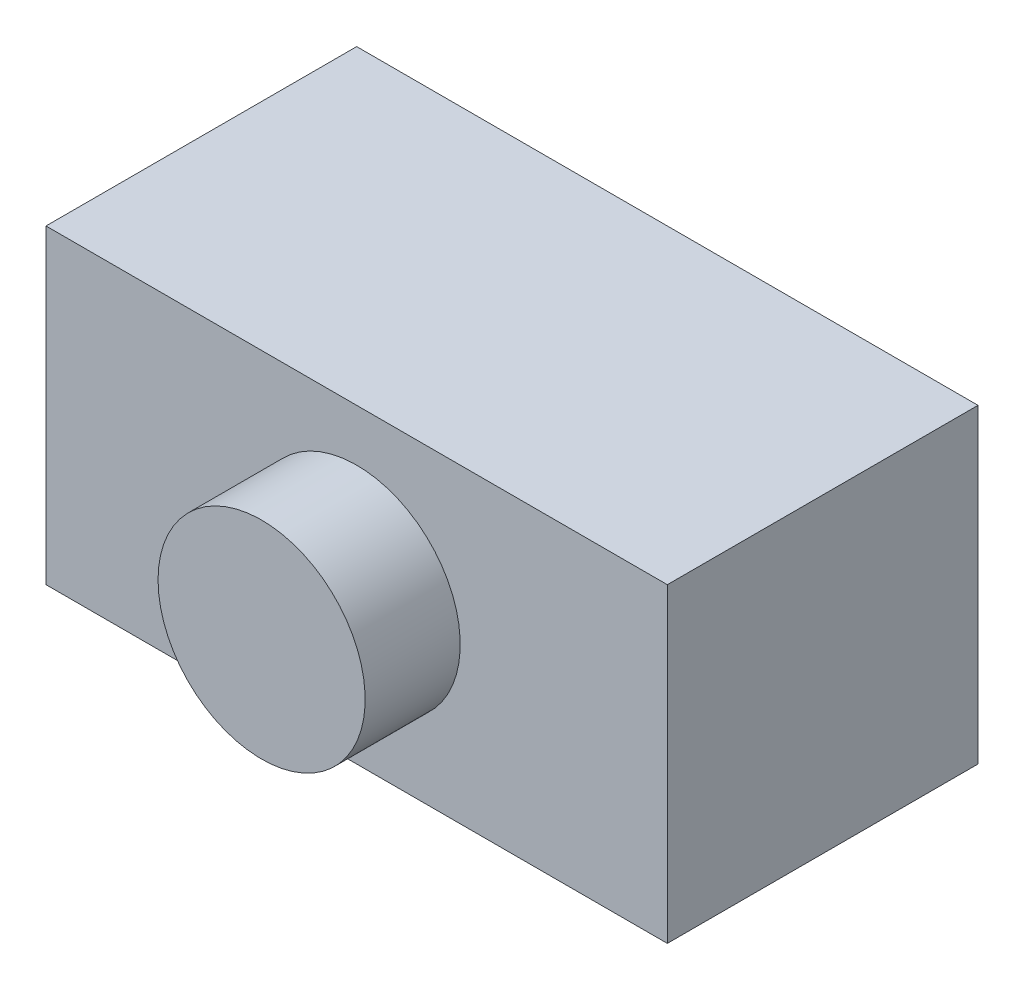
SolidWorks part; units mm, degrees
ref_plane "Front" through (0, 0, 0) normal (0, 0, 1) x (1, 0, 0)
ref_plane "Top" through (0, 0, 0) normal (0, 1, 0) x (1, 0, 0)
ref_plane "Right" through (0, 0, 0) normal (1, 0, 0) x (0, 0, -1)
sketch "Sketch1" plane through (0, 0, 0) normal (0, 0, 1) x (1, 0, 0)
  circle A0 centre (0, 0) radius 12.7
  dimension "D1" = 25.4
extrude "Base-Extrude" add sketch "Sketch1" along normal mid plane 11.6586
sketch "Sketch2" plane through (0, 0, -5.8293) normal (0, 0, -1) x (-1, 0, 0)
  line L0 (38.1, -19.05) -> (-38.1, 19.05) construction
  line L1 (38.1, -19.05) -> (-38.1, -19.05)
  line L2 (38.1, -19.05) -> (38.1, 19.05)
  line L3 (38.1, 19.05) -> (-38.1, 19.05)
  line L4 (-38.1, -19.05) -> (-38.1, 19.05)
  dimension "D1" = 76.2
  dimension "D2" = 38.1
extrude "Boss-Extrude1" add sketch "Sketch2" along normal blind 38.1
